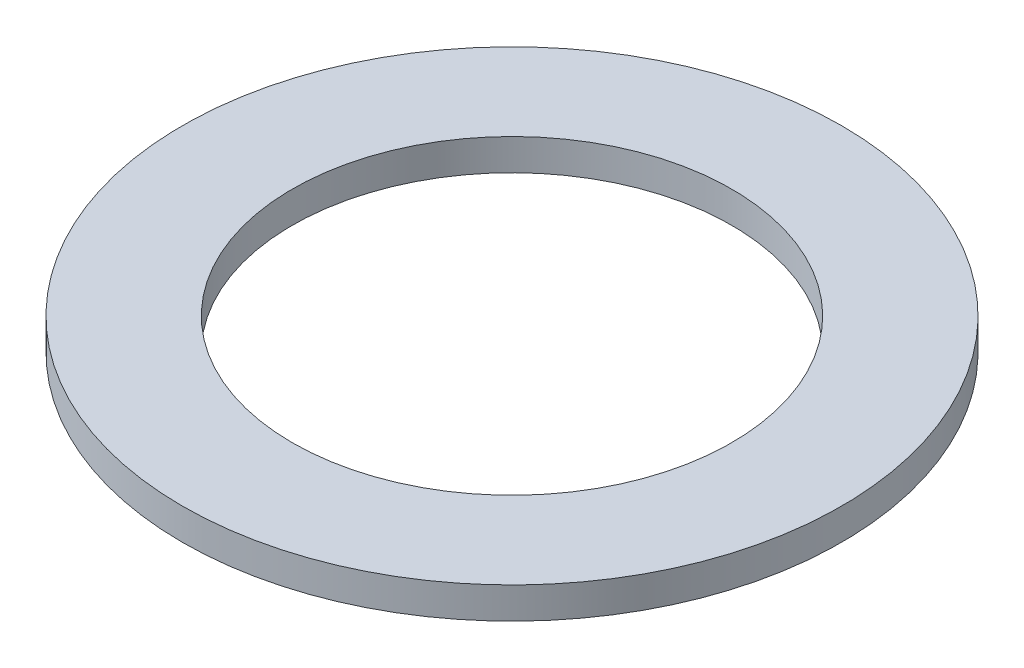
SolidWorks part; units mm, degrees
ref_plane "Plan1" through (0, 0, 0) normal (0, 0, 1) x (1, 0, 0)
ref_plane "Plan2" through (0, 0, 0) normal (0, 1, 0) x (1, 0, 0)
ref_plane "Plan3" through (0, 0, 0) normal (1, 0, 0) x (0, 0, -1)
sketch "Esquisse1" plane through (0, 0, 0) normal (0, 0, 1) x (1, 0, 0)
  line L0 (0, 28) -> (0, -23) construction
  line L1 (-7, 0) -> (-10.5, 0)
  line L2 (-10.5, 0) -> (-10.5, 1)
  line L3 (-10.5, 1) -> (-7, 1)
  line L5 (-7, 1) -> (-7, 0)
  dimension "D1" = 1
  dimension "D2" = 21
  dimension "D3" = 14
revolve "Base-Révolution" add sketch "Esquisse1" angle 360 about L0
